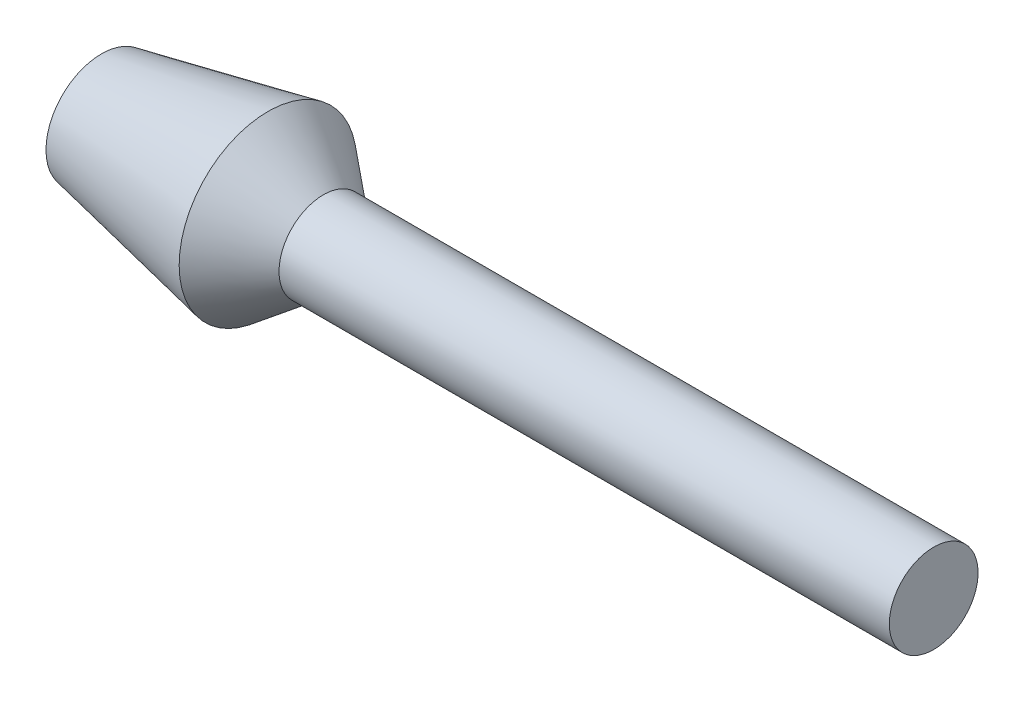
SolidWorks part; units mm, degrees
ref_plane "Front Plane" through (0, 0, 0) normal (0, 0, 1) x (1, 0, 0)
ref_plane "Top Plane" through (0, 0, 0) normal (0, 1, 0) x (1, 0, 0)
ref_plane "Right Plane" through (0, 0, 0) normal (1, 0, 0) x (0, 0, -1)
sketch "Sketch1" plane through (0, 0, 0) normal (0, 0, 1) x (1, 0, 0)
  line L0 (-23.1325, 0) -> (51.8675, 0)
  line L1 (51.8675, 0) -> (51.8675, -4)
  line L2 (51.8675, -4) -> (-3.1325, -4)
  line L3 (-3.1325, -4) -> (-8.1325, -8)
  line L4 (-8.1325, -8) -> (-23.1325, -5)
  line L5 (-23.1325, -5) -> (-23.1325, 0)
  dimension "D1" = 4
  dimension "D2" = 75
  dimension "D3" = 55
  dimension "D4" = 5
  dimension "D5" = 15
  dimension "D6" = 8
revolve "Revolve1" add sketch "Sketch1" angle 360 about L0
